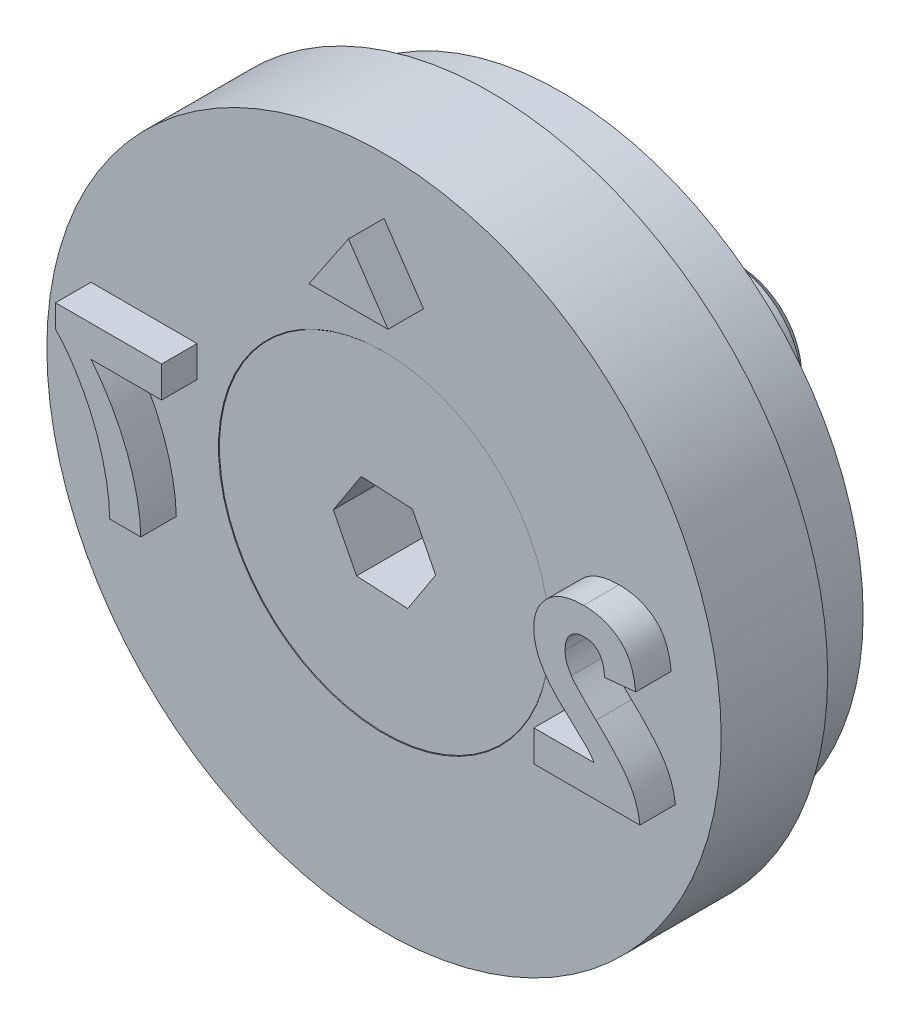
SolidWorks part; units mm, degrees
other "<M4 X .7 FHCS>-<Imported1>"
ref_plane "Front Plane" through (0, 0, 0) normal (0, 0, 1) x (1, 0, 0)
ref_plane "Top Plane" through (0, 0, 0) normal (0, 1, 0) x (1, 0, 0)
ref_plane "Right Plane" through (0, 0, 0) normal (1, 0, 0) x (0, 0, -1)
imported_body "Imported1"
other "DeleteFace1"
sketch "Sketch1" plane through (0, 0, 0) normal (0, 0, 1) x (1, 0, 0)
  line L0 (0, 7.9145) -> (-1.1129, 6.2645)
  line L1 (-1.1129, 6.2645) -> (1.1129, 6.2645)
  line L2 (1.1129, 6.2645) -> (0, 7.9145)
  text T0 "2      7" font "Arial" height 4.572
  dimension "D1" = 2.286
extrude "Boss-Extrude1" add sketch "Sketch1" along normal blind 1
inserted part "M4 X .7 FHCS"
move or copy body "Body-Move/Copy2" placed by mates yes
